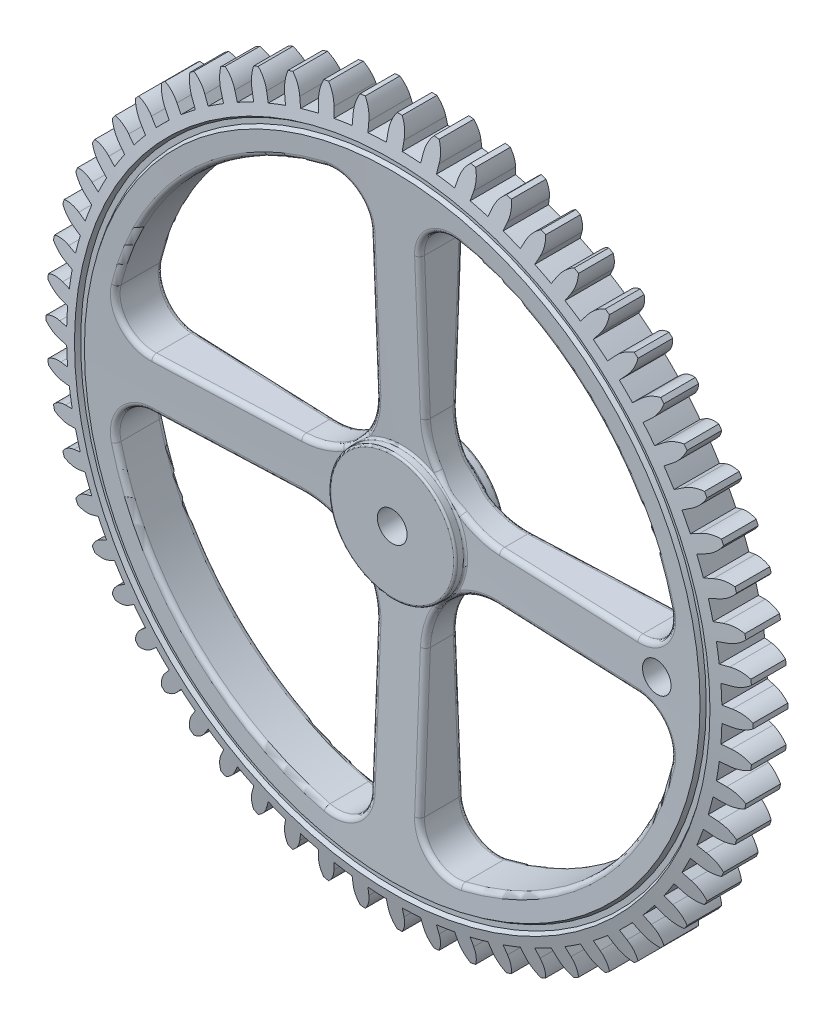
SolidWorks part; units mm, degrees
ref_plane "Front Plane" through (0, 0, 0) normal (0, 0, 1) x (1, 0, 0)
ref_plane "Top Plane" through (0, 0, 0) normal (0, 1, 0) x (1, 0, 0)
ref_plane "Right Plane" through (0, 0, 0) normal (1, 0, 0) x (0, 0, -1)
sketch "Sketch1" plane through (0, 0, 0) normal (1, 0, 0) x (0, 0, -1)
  line L0 (-5, 0) -> (5, 0)
  line L1 (-3.5, 71.3) -> (-5, 64.1)
  line L2 (3.5, 71.3) -> (-3.5, 71.3)
  line L3 (-5, 12.8) -> (-5, 0)
  line L4 (3.5, 71.3) -> (5, 64.1)
  line L5 (-5, 12.8) -> (-3, 12.8)
  line L6 (5, 62.1) -> (3, 12.8)
  line L7 (-4.2534, 63.6) -> (-4.2534, 62.6)
  line L8 (-5, 62.1) -> (-4.2534, 62.6)
  line L9 (-5, 64.1) -> (-4.2534, 63.6)
  line L10 (-5, 62.1) -> (-3, 12.8)
  line L11 (5, 12.8) -> (5, 0)
  line L12 (5, 62.1) -> (4.2534, 62.6)
  line L13 (4.2534, 63.6) -> (4.2534, 62.6)
  line L14 (5, 64.1) -> (4.2534, 63.6)
  line L15 (3, 12.8) -> (5, 12.8)
  line L16 (-5, 12.8) -> (5, 12.8) construction
  point P12 (-3, 12.8)
  dimension "D1" = 7
  dimension "D2" = 5
  dimension "D4" = 1.5
  dimension "D3" = 71.3
  dimension "D6" = 2
  dimension "D7" = 1
  dimension "D8" = 0.5
  dimension "D10" = 2
  dimension "D5" = 12.8
revolve "Revolve1" add sketch "Sketch1" angle 360 about L0
sketch "Sketch2" plane through (0, 0, 0) normal (0, 0, 1) x (1, 0, 0)
  line L0 (0.51, 71.2982) -> (-0.51, 71.2982)
  line L1 (5.499, 67.6268) -> (5.3161, 65.8859)
  line L2 (-1.6, 67.8311) -> (-1.6, 66.0806)
  line L3 (1.6, 67.8311) -> (1.6, 66.0806)
  line L4 (7.9599, 70.8543) -> (6.9455, 70.9609)
  line L5 (8.6815, 67.2923) -> (8.4985, 65.5514)
  line L6 (12.5378, 66.6815) -> (12.1739, 64.9693)
  line L7 (15.3226, 69.6341) -> (14.3249, 69.8462)
  line L8 (15.6679, 66.0162) -> (15.304, 64.304)
  line L9 (19.4393, 65.0057) -> (18.8983, 63.3408)
  line L10 (22.5174, 67.651) -> (21.5473, 67.9662)
  line L11 (22.4827, 64.0168) -> (21.9417, 62.352)
  line L12 (26.1277, 62.6176) -> (25.4157, 61.0184)
  line L13 (29.4655, 64.9267) -> (28.5337, 65.3416)
  line L14 (29.0511, 61.316) -> (28.3391, 59.7169)
  line L15 (32.5299, 59.5435) -> (31.6547, 58.0275)
  line L16 (36.0908, 61.491) -> (35.2074, 62.001)
  line L17 (35.3012, 57.9435) -> (34.426, 56.4275)
  line L18 (38.5757, 55.817) -> (37.5468, 54.4008)
  line L19 (42.3206, 57.3817) -> (41.4954, 57.9812)
  line L20 (41.1646, 53.9361) -> (40.1356, 52.5199)
  line L21 (44.1989, 51.479) -> (43.0275, 50.1781)
  line L22 (48.0868, 52.6436) -> (47.3288, 53.3261)
  line L23 (46.5769, 49.3377) -> (45.4056, 48.0369)
  line L24 (49.3377, 46.5769) -> (48.0369, 45.4056)
  line L25 (53.3261, 47.3288) -> (52.6436, 48.0868)
  line L26 (51.479, 44.1989) -> (50.1781, 43.0275)
  line L27 (53.9361, 41.1646) -> (52.5199, 40.1356)
  line L28 (57.9812, 41.4954) -> (57.3817, 42.3206)
  line L29 (55.817, 38.5757) -> (54.4008, 37.5468)
  line L30 (57.9435, 35.3012) -> (56.4275, 34.426)
  line L31 (62.001, 35.2074) -> (61.491, 36.0908)
  line L32 (59.5435, 32.5299) -> (58.0275, 31.6547)
  line L33 (61.316, 29.0511) -> (59.7169, 28.3391)
  line L34 (65.3416, 28.5337) -> (64.9267, 29.4655)
  line L35 (62.6176, 26.1277) -> (61.0184, 25.4157)
  line L36 (64.0168, 22.4827) -> (62.352, 21.9417)
  line L37 (67.9662, 21.5473) -> (67.651, 22.5174)
  line L38 (65.0057, 19.4393) -> (63.3408, 18.8983)
  line L39 (66.0162, 15.6679) -> (64.304, 15.304)
  line L40 (69.8462, 14.3249) -> (69.6341, 15.3226)
  line L41 (66.6815, 12.5378) -> (64.9693, 12.1739)
  line L42 (67.2923, 8.6815) -> (65.5514, 8.4985)
  line L43 (70.9609, 6.9455) -> (70.8543, 7.9599)
  line L44 (67.6268, 5.499) -> (65.8859, 5.3161)
  line L45 (67.8311, 1.6) -> (66.0806, 1.6)
  line L46 (71.2982, -0.51) -> (71.2982, 0.51)
  line L47 (67.8311, -1.6) -> (66.0806, -1.6)
  line L48 (67.6268, -5.499) -> (65.8859, -5.3161)
  line L49 (70.8543, -7.9599) -> (70.9609, -6.9455)
  line L50 (67.2923, -8.6815) -> (65.5514, -8.4985)
  line L51 (66.6815, -12.5378) -> (64.9693, -12.1739)
  line L52 (69.6341, -15.3226) -> (69.8462, -14.3249)
  line L53 (66.0162, -15.6679) -> (64.304, -15.304)
  line L54 (65.0057, -19.4393) -> (63.3408, -18.8983)
  line L55 (67.651, -22.5174) -> (67.9662, -21.5473)
  line L56 (64.0168, -22.4827) -> (62.352, -21.9417)
  line L57 (62.6176, -26.1277) -> (61.0184, -25.4157)
  line L58 (64.9267, -29.4655) -> (65.3416, -28.5337)
  line L59 (61.316, -29.0511) -> (59.7169, -28.3391)
  line L60 (59.5435, -32.5299) -> (58.0275, -31.6547)
  line L61 (61.491, -36.0908) -> (62.001, -35.2074)
  line L62 (57.9435, -35.3012) -> (56.4275, -34.426)
  line L63 (55.817, -38.5757) -> (54.4008, -37.5468)
  line L64 (57.3817, -42.3206) -> (57.9812, -41.4954)
  line L65 (53.9361, -41.1646) -> (52.5199, -40.1356)
  line L66 (51.479, -44.1989) -> (50.1781, -43.0275)
  line L67 (52.6436, -48.0868) -> (53.3261, -47.3288)
  line L68 (49.3377, -46.5769) -> (48.0369, -45.4056)
  line L69 (46.5769, -49.3377) -> (45.4056, -48.0369)
  line L70 (47.3288, -53.3261) -> (48.0868, -52.6436)
  line L71 (44.1989, -51.479) -> (43.0275, -50.1781)
  line L72 (41.1646, -53.9361) -> (40.1356, -52.5199)
  line L73 (41.4954, -57.9812) -> (42.3206, -57.3817)
  line L74 (38.5757, -55.817) -> (37.5468, -54.4008)
  line L75 (35.3012, -57.9435) -> (34.426, -56.4275)
  line L76 (35.2074, -62.001) -> (36.0908, -61.491)
  line L77 (32.5299, -59.5435) -> (31.6547, -58.0275)
  line L78 (29.0511, -61.316) -> (28.3391, -59.7169)
  line L79 (28.5337, -65.3416) -> (29.4655, -64.9267)
  line L80 (26.1277, -62.6176) -> (25.4157, -61.0184)
  line L81 (22.4827, -64.0168) -> (21.9417, -62.352)
  line L82 (21.5473, -67.9662) -> (22.5174, -67.651)
  line L83 (19.4393, -65.0057) -> (18.8983, -63.3408)
  line L84 (15.6679, -66.0162) -> (15.304, -64.304)
  line L85 (14.3249, -69.8462) -> (15.3226, -69.6341)
  line L86 (12.5378, -66.6815) -> (12.1739, -64.9693)
  line L87 (8.6815, -67.2923) -> (8.4985, -65.5514)
  line L88 (6.9455, -70.9609) -> (7.9599, -70.8543)
  line L89 (5.499, -67.6268) -> (5.3161, -65.8859)
  line L90 (1.6, -67.8311) -> (1.6, -66.0806)
  line L91 (-0.51, -71.2982) -> (0.51, -71.2982)
  line L92 (-1.6, -67.8311) -> (-1.6, -66.0806)
  line L93 (-5.499, -67.6268) -> (-5.3161, -65.8859)
  line L94 (-7.9599, -70.8543) -> (-6.9455, -70.9609)
  line L95 (-8.6815, -67.2923) -> (-8.4985, -65.5514)
  line L96 (-12.5378, -66.6815) -> (-12.1739, -64.9693)
  line L97 (-15.3226, -69.6341) -> (-14.3249, -69.8462)
  line L98 (-15.6679, -66.0162) -> (-15.304, -64.304)
  line L99 (-19.4393, -65.0057) -> (-18.8983, -63.3408)
  line L100 (-22.5174, -67.651) -> (-21.5473, -67.9662)
  line L101 (-22.4827, -64.0168) -> (-21.9417, -62.352)
  line L102 (-26.1277, -62.6176) -> (-25.4157, -61.0184)
  line L103 (-29.4655, -64.9267) -> (-28.5337, -65.3416)
  line L104 (-29.0511, -61.316) -> (-28.3391, -59.7169)
  line L105 (-32.5299, -59.5435) -> (-31.6547, -58.0275)
  line L106 (-36.0908, -61.491) -> (-35.2074, -62.001)
  line L107 (-35.3012, -57.9435) -> (-34.426, -56.4275)
  line L108 (-38.5757, -55.817) -> (-37.5468, -54.4008)
  line L109 (-42.3206, -57.3817) -> (-41.4954, -57.9812)
  line L110 (-41.1646, -53.9361) -> (-40.1356, -52.5199)
  line L111 (-44.1989, -51.479) -> (-43.0275, -50.1781)
  line L112 (-48.0868, -52.6436) -> (-47.3288, -53.3261)
  line L113 (-46.5769, -49.3377) -> (-45.4056, -48.0369)
  line L114 (-49.3377, -46.5769) -> (-48.0369, -45.4056)
  line L115 (-53.3261, -47.3288) -> (-52.6436, -48.0868)
  line L116 (-51.479, -44.1989) -> (-50.1781, -43.0275)
  line L117 (-53.9361, -41.1646) -> (-52.5199, -40.1356)
  line L118 (-57.9812, -41.4954) -> (-57.3817, -42.3206)
  line L119 (-55.817, -38.5757) -> (-54.4008, -37.5468)
  line L120 (-57.9435, -35.3012) -> (-56.4275, -34.426)
  line L121 (-62.001, -35.2074) -> (-61.491, -36.0908)
  line L122 (-59.5435, -32.5299) -> (-58.0275, -31.6547)
  line L123 (-61.316, -29.0511) -> (-59.7169, -28.3391)
  line L124 (-65.3416, -28.5337) -> (-64.9267, -29.4655)
  line L125 (-62.6176, -26.1277) -> (-61.0184, -25.4157)
  line L126 (-64.0168, -22.4827) -> (-62.352, -21.9417)
  line L127 (-67.9662, -21.5473) -> (-67.651, -22.5174)
  line L128 (-65.0057, -19.4393) -> (-63.3408, -18.8983)
  line L129 (-66.0162, -15.6679) -> (-64.304, -15.304)
  line L130 (-69.8462, -14.3249) -> (-69.6341, -15.3226)
  line L131 (-66.6815, -12.5378) -> (-64.9693, -12.1739)
  line L132 (-67.2923, -8.6815) -> (-65.5514, -8.4985)
  line L133 (-70.9609, -6.9455) -> (-70.8543, -7.9599)
  line L134 (-67.6268, -5.499) -> (-65.8859, -5.3161)
  line L135 (-67.8311, -1.6) -> (-66.0806, -1.6)
  line L136 (-71.2982, 0.51) -> (-71.2982, -0.51)
  line L137 (-67.8311, 1.6) -> (-66.0806, 1.6)
  line L138 (-67.6268, 5.499) -> (-65.8859, 5.3161)
  line L139 (-70.8543, 7.9599) -> (-70.9609, 6.9455)
  line L140 (-67.2923, 8.6815) -> (-65.5514, 8.4985)
  line L141 (-66.6815, 12.5378) -> (-64.9693, 12.1739)
  line L142 (-69.6341, 15.3226) -> (-69.8462, 14.3249)
  line L143 (-66.0162, 15.6679) -> (-64.304, 15.304)
  line L144 (-65.0057, 19.4393) -> (-63.3408, 18.8983)
  line L145 (-67.651, 22.5174) -> (-67.9662, 21.5473)
  line L146 (-64.0168, 22.4827) -> (-62.352, 21.9417)
  line L147 (-62.6176, 26.1277) -> (-61.0184, 25.4157)
  line L148 (-64.9267, 29.4655) -> (-65.3416, 28.5337)
  line L149 (-61.316, 29.0511) -> (-59.7169, 28.3391)
  line L150 (-59.5435, 32.5299) -> (-58.0275, 31.6547)
  line L151 (-61.491, 36.0908) -> (-62.001, 35.2074)
  line L152 (-57.9435, 35.3012) -> (-56.4275, 34.426)
  line L153 (-55.817, 38.5757) -> (-54.4008, 37.5468)
  line L154 (-57.3817, 42.3206) -> (-57.9812, 41.4954)
  line L155 (-53.9361, 41.1646) -> (-52.5199, 40.1356)
  line L156 (-51.479, 44.1989) -> (-50.1781, 43.0275)
  line L157 (-52.6436, 48.0868) -> (-53.3261, 47.3288)
  line L158 (-49.3377, 46.5769) -> (-48.0369, 45.4056)
  line L159 (-46.5769, 49.3377) -> (-45.4056, 48.0369)
  line L160 (-47.3288, 53.3261) -> (-48.0868, 52.6436)
  line L161 (-44.1989, 51.479) -> (-43.0275, 50.1781)
  line L162 (-41.1646, 53.9361) -> (-40.1356, 52.5199)
  line L163 (-41.4954, 57.9812) -> (-42.3206, 57.3817)
  line L164 (-38.5757, 55.817) -> (-37.5468, 54.4008)
  line L165 (-35.3012, 57.9435) -> (-34.426, 56.4275)
  line L166 (-35.2074, 62.001) -> (-36.0908, 61.491)
  line L167 (-32.5299, 59.5435) -> (-31.6547, 58.0275)
  line L168 (-29.0511, 61.316) -> (-28.3391, 59.7169)
  line L169 (-28.5337, 65.3416) -> (-29.4655, 64.9267)
  line L170 (-26.1277, 62.6176) -> (-25.4157, 61.0184)
  line L171 (-22.4827, 64.0168) -> (-21.9417, 62.352)
  line L172 (-21.5473, 67.9662) -> (-22.5174, 67.651)
  line L173 (-19.4393, 65.0057) -> (-18.8983, 63.3408)
  line L174 (-15.6679, 66.0162) -> (-15.304, 64.304)
  line L175 (-14.3249, 69.8462) -> (-15.3226, 69.6341)
  line L176 (-12.5378, 66.6815) -> (-12.1739, 64.9693)
  line L177 (-8.6815, 67.2923) -> (-8.4985, 65.5514)
  line L178 (-6.9455, 70.9609) -> (-7.9599, 70.8543)
  line L179 (-5.499, 67.6268) -> (-5.3161, 65.8859)
  arc A0 (6.9455, 70.9609) -> (5.499, 67.6268) centre (11.4681, 67.0181) ccw
  arc A1 (-1.6, 66.0806) -> (1.6, 66.0806) centre (0, 0) ccw
  circle A2 centre (0, 0) radius 71.3 construction
  arc A3 (-0.51, 71.2982) -> (-1.6, 67.8311) centre (4.4, 67.8497) ccw
  arc A4 (0.51, 71.2982) -> (1.6, 67.8311) centre (-4.4, 67.8497) cw
  arc A5 (7.9599, 70.8543) -> (8.6815, 67.2923) centre (2.7164, 67.9379) cw
  arc A6 (14.3249, 69.8462) -> (12.5378, 66.6815) centre (18.4106, 65.4522) ccw
  arc A7 (15.3226, 69.6341) -> (15.6679, 66.0162) centre (9.8029, 67.2818) cw
  arc A8 (21.5473, 67.9662) -> (19.4393, 65.0057) centre (25.1513, 63.1692) ccw
  arc A9 (22.5174, 67.651) -> (22.4827, 64.0168) centre (16.7821, 65.8885) cw
  arc A10 (28.5337, 65.3416) -> (26.1277, 62.6176) centre (31.6165, 60.1941) ccw
  arc A11 (29.4655, 64.9267) -> (29.0511, 61.316) centre (23.5774, 63.7734) cw
  arc A12 (35.2074, 62.001) -> (32.5299, 59.5435) centre (37.7353, 56.5596) ccw
  arc A13 (36.0908, 61.491) -> (35.3012, 57.9435) centre (30.1143, 60.9595) cw
  arc A14 (41.4954, 57.9812) -> (38.5757, 55.817) centre (43.4407, 52.3053) ccw
  arc A15 (42.3206, 57.3817) -> (41.1646, 53.9361) centre (36.3214, 57.4778) cw
  arc A16 (47.3288, 53.3261) -> (44.1989, 51.479) centre (48.6701, 47.478) ccw
  arc A17 (48.0868, 52.6436) -> (46.5769, 49.3377) centre (42.1305, 53.3663) cw
  arc A18 (52.6436, 48.0868) -> (49.3377, 46.5769) centre (53.3663, 42.1305) ccw
  arc A19 (53.3261, 47.3288) -> (51.479, 44.1989) centre (47.478, 48.6701) cw
  arc A20 (57.3817, 42.3206) -> (53.9361, 41.1646) centre (57.4778, 36.3214) ccw
  arc A21 (57.9812, 41.4954) -> (55.817, 38.5757) centre (52.3053, 43.4407) cw
  arc A22 (61.491, 36.0908) -> (57.9435, 35.3012) centre (60.9595, 30.1143) ccw
  arc A23 (62.001, 35.2074) -> (59.5435, 32.5299) centre (56.5596, 37.7353) cw
  arc A24 (64.9267, 29.4655) -> (61.316, 29.0511) centre (63.7734, 23.5774) ccw
  arc A25 (65.3416, 28.5337) -> (62.6176, 26.1277) centre (60.1941, 31.6165) cw
  arc A26 (67.651, 22.5174) -> (64.0168, 22.4827) centre (65.8885, 16.7821) ccw
  arc A27 (67.9662, 21.5473) -> (65.0057, 19.4393) centre (63.1692, 25.1513) cw
  arc A28 (69.6341, 15.3226) -> (66.0162, 15.6679) centre (67.2818, 9.8029) ccw
  arc A29 (69.8462, 14.3249) -> (66.6815, 12.5378) centre (65.4522, 18.4106) cw
  arc A30 (70.8543, 7.9599) -> (67.2923, 8.6815) centre (67.9379, 2.7164) ccw
  arc A31 (70.9609, 6.9455) -> (67.6268, 5.499) centre (67.0181, 11.4681) cw
  arc A32 (71.2982, 0.51) -> (67.8311, 1.6) centre (67.8497, -4.4) ccw
  arc A33 (71.2982, -0.51) -> (67.8311, -1.6) centre (67.8497, 4.4) cw
  arc A34 (70.9609, -6.9455) -> (67.6268, -5.499) centre (67.0181, -11.4681) ccw
  arc A35 (70.8543, -7.9599) -> (67.2923, -8.6815) centre (67.9379, -2.7164) cw
  arc A36 (69.8462, -14.3249) -> (66.6815, -12.5378) centre (65.4522, -18.4106) ccw
  arc A37 (69.6341, -15.3226) -> (66.0162, -15.6679) centre (67.2818, -9.8029) cw
  arc A38 (67.9662, -21.5473) -> (65.0057, -19.4393) centre (63.1692, -25.1513) ccw
  arc A39 (67.651, -22.5174) -> (64.0168, -22.4827) centre (65.8885, -16.7821) cw
  arc A40 (65.3416, -28.5337) -> (62.6176, -26.1277) centre (60.1941, -31.6165) ccw
  arc A41 (64.9267, -29.4655) -> (61.316, -29.0511) centre (63.7734, -23.5774) cw
  arc A42 (62.001, -35.2074) -> (59.5435, -32.5299) centre (56.5596, -37.7353) ccw
  arc A43 (61.491, -36.0908) -> (57.9435, -35.3012) centre (60.9595, -30.1143) cw
  arc A44 (57.9812, -41.4954) -> (55.817, -38.5757) centre (52.3053, -43.4407) ccw
  arc A45 (57.3817, -42.3206) -> (53.9361, -41.1646) centre (57.4778, -36.3214) cw
  arc A46 (53.3261, -47.3288) -> (51.479, -44.1989) centre (47.478, -48.6701) ccw
  arc A47 (52.6436, -48.0868) -> (49.3377, -46.5769) centre (53.3663, -42.1305) cw
  arc A48 (48.0868, -52.6436) -> (46.5769, -49.3377) centre (42.1305, -53.3663) ccw
  arc A49 (47.3288, -53.3261) -> (44.1989, -51.479) centre (48.6701, -47.478) cw
  arc A50 (42.3206, -57.3817) -> (41.1646, -53.9361) centre (36.3214, -57.4778) ccw
  arc A51 (41.4954, -57.9812) -> (38.5757, -55.817) centre (43.4407, -52.3053) cw
  arc A52 (36.0908, -61.491) -> (35.3012, -57.9435) centre (30.1143, -60.9595) ccw
  arc A53 (35.2074, -62.001) -> (32.5299, -59.5435) centre (37.7353, -56.5596) cw
  arc A54 (29.4655, -64.9267) -> (29.0511, -61.316) centre (23.5774, -63.7734) ccw
  arc A55 (28.5337, -65.3416) -> (26.1277, -62.6176) centre (31.6165, -60.1941) cw
  arc A56 (22.5174, -67.651) -> (22.4827, -64.0168) centre (16.7821, -65.8885) ccw
  arc A57 (21.5473, -67.9662) -> (19.4393, -65.0057) centre (25.1513, -63.1692) cw
  arc A58 (15.3226, -69.6341) -> (15.6679, -66.0162) centre (9.8029, -67.2818) ccw
  arc A59 (14.3249, -69.8462) -> (12.5378, -66.6815) centre (18.4106, -65.4522) cw
  arc A60 (7.9599, -70.8543) -> (8.6815, -67.2923) centre (2.7164, -67.9379) ccw
  arc A61 (6.9455, -70.9609) -> (5.499, -67.6268) centre (11.4681, -67.0181) cw
  arc A62 (0.51, -71.2982) -> (1.6, -67.8311) centre (-4.4, -67.8497) ccw
  arc A63 (-0.51, -71.2982) -> (-1.6, -67.8311) centre (4.4, -67.8497) cw
  arc A64 (-6.9455, -70.9609) -> (-5.499, -67.6268) centre (-11.4681, -67.0181) ccw
  arc A65 (-7.9599, -70.8543) -> (-8.6815, -67.2923) centre (-2.7164, -67.9379) cw
  arc A66 (-14.3249, -69.8462) -> (-12.5378, -66.6815) centre (-18.4106, -65.4522) ccw
  arc A67 (-15.3226, -69.6341) -> (-15.6679, -66.0162) centre (-9.8029, -67.2818) cw
  arc A68 (-21.5473, -67.9662) -> (-19.4393, -65.0057) centre (-25.1513, -63.1692) ccw
  arc A69 (-22.5174, -67.651) -> (-22.4827, -64.0168) centre (-16.7821, -65.8885) cw
  arc A70 (-28.5337, -65.3416) -> (-26.1277, -62.6176) centre (-31.6165, -60.1941) ccw
  arc A71 (-29.4655, -64.9267) -> (-29.0511, -61.316) centre (-23.5774, -63.7734) cw
  arc A72 (-35.2074, -62.001) -> (-32.5299, -59.5435) centre (-37.7353, -56.5596) ccw
  arc A73 (-36.0908, -61.491) -> (-35.3012, -57.9435) centre (-30.1143, -60.9595) cw
  arc A74 (-41.4954, -57.9812) -> (-38.5757, -55.817) centre (-43.4407, -52.3053) ccw
  arc A75 (-42.3206, -57.3817) -> (-41.1646, -53.9361) centre (-36.3214, -57.4778) cw
  arc A76 (-47.3288, -53.3261) -> (-44.1989, -51.479) centre (-48.6701, -47.478) ccw
  arc A77 (-48.0868, -52.6436) -> (-46.5769, -49.3377) centre (-42.1305, -53.3663) cw
  arc A78 (-52.6436, -48.0868) -> (-49.3377, -46.5769) centre (-53.3663, -42.1305) ccw
  arc A79 (-53.3261, -47.3288) -> (-51.479, -44.1989) centre (-47.478, -48.6701) cw
  arc A80 (-57.3817, -42.3206) -> (-53.9361, -41.1646) centre (-57.4778, -36.3214) ccw
  arc A81 (-57.9812, -41.4954) -> (-55.817, -38.5757) centre (-52.3053, -43.4407) cw
  arc A82 (-61.491, -36.0908) -> (-57.9435, -35.3012) centre (-60.9595, -30.1143) ccw
  arc A83 (-62.001, -35.2074) -> (-59.5435, -32.5299) centre (-56.5596, -37.7353) cw
  arc A84 (-64.9267, -29.4655) -> (-61.316, -29.0511) centre (-63.7734, -23.5774) ccw
  arc A85 (-65.3416, -28.5337) -> (-62.6176, -26.1277) centre (-60.1941, -31.6165) cw
  arc A86 (-67.651, -22.5174) -> (-64.0168, -22.4827) centre (-65.8885, -16.7821) ccw
  arc A87 (-67.9662, -21.5473) -> (-65.0057, -19.4393) centre (-63.1692, -25.1513) cw
  arc A88 (-69.6341, -15.3226) -> (-66.0162, -15.6679) centre (-67.2818, -9.8029) ccw
  arc A89 (-69.8462, -14.3249) -> (-66.6815, -12.5378) centre (-65.4522, -18.4106) cw
  arc A90 (-70.8543, -7.9599) -> (-67.2923, -8.6815) centre (-67.9379, -2.7164) ccw
  arc A91 (-70.9609, -6.9455) -> (-67.6268, -5.499) centre (-67.0181, -11.4681) cw
  arc A92 (-71.2982, -0.51) -> (-67.8311, -1.6) centre (-67.8497, 4.4) ccw
  arc A93 (-71.2982, 0.51) -> (-67.8311, 1.6) centre (-67.8497, -4.4) cw
  arc A94 (-70.9609, 6.9455) -> (-67.6268, 5.499) centre (-67.0181, 11.4681) ccw
  arc A95 (-70.8543, 7.9599) -> (-67.2923, 8.6815) centre (-67.9379, 2.7164) cw
  arc A96 (-69.8462, 14.3249) -> (-66.6815, 12.5378) centre (-65.4522, 18.4106) ccw
  arc A97 (-69.6341, 15.3226) -> (-66.0162, 15.6679) centre (-67.2818, 9.8029) cw
  arc A98 (-67.9662, 21.5473) -> (-65.0057, 19.4393) centre (-63.1692, 25.1513) ccw
  arc A99 (-67.651, 22.5174) -> (-64.0168, 22.4827) centre (-65.8885, 16.7821) cw
  arc A100 (-65.3416, 28.5337) -> (-62.6176, 26.1277) centre (-60.1941, 31.6165) ccw
  arc A101 (-64.9267, 29.4655) -> (-61.316, 29.0511) centre (-63.7734, 23.5774) cw
  arc A102 (-62.001, 35.2074) -> (-59.5435, 32.5299) centre (-56.5596, 37.7353) ccw
  arc A103 (-61.491, 36.0908) -> (-57.9435, 35.3012) centre (-60.9595, 30.1143) cw
  arc A104 (-57.9812, 41.4954) -> (-55.817, 38.5757) centre (-52.3053, 43.4407) ccw
  arc A105 (-57.3817, 42.3206) -> (-53.9361, 41.1646) centre (-57.4778, 36.3214) cw
  arc A106 (-53.3261, 47.3288) -> (-51.479, 44.1989) centre (-47.478, 48.6701) ccw
  arc A107 (-52.6436, 48.0868) -> (-49.3377, 46.5769) centre (-53.3663, 42.1305) cw
  arc A108 (-48.0868, 52.6436) -> (-46.5769, 49.3377) centre (-42.1305, 53.3663) ccw
  arc A109 (-47.3288, 53.3261) -> (-44.1989, 51.479) centre (-48.6701, 47.478) cw
  arc A110 (-42.3206, 57.3817) -> (-41.1646, 53.9361) centre (-36.3214, 57.4778) ccw
  arc A111 (-41.4954, 57.9812) -> (-38.5757, 55.817) centre (-43.4407, 52.3053) cw
  arc A112 (-36.0908, 61.491) -> (-35.3012, 57.9435) centre (-30.1143, 60.9595) ccw
  arc A113 (-35.2074, 62.001) -> (-32.5299, 59.5435) centre (-37.7353, 56.5596) cw
  arc A114 (-29.4655, 64.9267) -> (-29.0511, 61.316) centre (-23.5774, 63.7734) ccw
  arc A115 (-28.5337, 65.3416) -> (-26.1277, 62.6176) centre (-31.6165, 60.1941) cw
  arc A116 (-22.5174, 67.651) -> (-22.4827, 64.0168) centre (-16.7821, 65.8885) ccw
  arc A117 (-21.5473, 67.9662) -> (-19.4393, 65.0057) centre (-25.1513, 63.1692) cw
  arc A118 (-15.3226, 69.6341) -> (-15.6679, 66.0162) centre (-9.8029, 67.2818) ccw
  arc A119 (-14.3249, 69.8462) -> (-12.5378, 66.6815) centre (-18.4106, 65.4522) cw
  arc A120 (-7.9599, 70.8543) -> (-8.6815, 67.2923) centre (-2.7164, 67.9379) ccw
  arc A121 (-6.9455, 70.9609) -> (-5.499, 67.6268) centre (-11.4681, 67.0181) cw
  circle A122 centre (0, 0) radius 71.3
  point P9 (0, 71.2982)
  point P487 (0, 0)
  dimension "D1" = 60
  dimension "D2" = 132.2
  dimension "D7" = 6
  dimension "D8" = 6
  dimension "D3" = 1.02
  dimension "D4" = 0.51
extrude "Cut-Extrude2" cut sketch "Sketch2" against normal through all both and the other way through all contours A114 A122 A113 L167 A1 L168 | A116 A122 A115 L170 A1 L171 | A118 A122 A117 L173 A1 L174 | A120 A122 A119 L176 A1 L177 | A3 A122 A121 L179 A1 L2 | A0 A122 A4 L3 A1 L1 | A6 A122 A5 L5 A1 L6 | A8 A122 A7 L8 A1 L9 | A10 A122 A9 L11 A1 L12 | A12 A122 A11 L14 A1 L15 | A14 A122 A13 L17 A1 L18 | A16 A122 A15 L20 A1 L21 | A18 A122 A17 L23 A1 L24 | A20 A122 A19 L26 A1 L27 | A22 A122 A21 L29 A1 L30 | A24 A122 A23 L32 A1 L33 | A26 A122 A25 L35 A1 L36 | A28 A122 A27 L38 A1 L39 | A30 A122 A29 L41 A1 L42 | A32 A122 A31 L44 A1 L45 | A34 A122 A33 L47 A1 L48 | A36 A122 A35 L50 A1 L51 | A38 A122 A37 L53 A1 L54 | A40 A122 A39 L56 A1 L57 | A42 A122 A41 L59 A1 L60 | A44 A122 A43 L62 A1 L63 | A46 A122 A45 L65 A1 L66 | A48 A122 A47 L68 A1 L69 | A50 A122 A49 L71 A1 L72 | A52 A122 A51 L74 A1 L75 | A54 A122 A53 L77 A1 L78 | A56 A122 A55 L80 A1 L81 | A58 A122 A57 L83 A1 L84 | A60 A122 A59 L86 A1 L87 | A62 A122 A61 L89 A1 L90 | A64 A122 A63 L92 A1 L93 | A66 A122 A65 L95 A1 L96 | A68 A122 A67 L98 A1 L99 | A70 A122 A69 L101 A1 L102 | A72 A122 A71 L104 A1 L105 | A74 A122 A73 L107 A1 L108 | A76 A122 A75 L110 A1 L111 | A78 A122 A77 L113 A1 L114 | A80 A122 A79 L116 A1 L117 | A82 A122 A81 L119 A1 L120 | A84 A122 A83 L122 A1 L123 | A86 A122 A85 L125 A1 L126 | A88 A122 A87 L128 A1 L129 | A90 A122 A89 L131 A1 L132 | A92 A122 A91 L134 A1 L135 | A94 A122 A93 L137 A1 L138 | A96 A122 A95 L140 A1 L141 | A98 A122 A97 L143 A1 L144 | A100 A122 A99 L146 A1 L147 | A102 A122 A101 L149 A1 L150 | A104 A122 A103 L152 A1 L153 | A106 A122 A105 L155 A1 L156 | A108 A122 A107 L158 A1 L159 | A110 A122 A109 L161 A1 L162 | A112 A122 A111 L164 A1 L165
sketch "Sketch3" plane through (0, 0, 0) normal (0, 0, 1) x (1, 0, 0)
  line L0 (20, -5) -> (49.0535, -5)
  line L1 (5, -20) -> (5, -49.0535)
  line L2 (5, 20) -> (5, 49.0535)
  line L3 (20, 5) -> (49.0535, 5)
  line L4 (-5, -20) -> (-5, -49.0535)
  line L5 (-20, -5) -> (-49.0535, -5)
  line L6 (-20, 5) -> (-49.0535, 5)
  line L7 (-5, 20) -> (-5, 49.0535)
  arc A0 (49.0535, -5) -> (55.853, -13.6634) centre (49.0535, -12) cw
  arc A1 (55.853, 13.6634) -> (13.6634, 55.853) centre (0, 0) ccw
  arc A2 (49.0535, 5) -> (55.853, 13.6634) centre (49.0535, 12) ccw
  arc A3 (5, 49.0535) -> (13.6634, 55.853) centre (12, 49.0535) cw
  arc A4 (5, 20) -> (20, 5) centre (20, 20) ccw
  arc A5 (13.6634, -55.853) -> (55.853, -13.6634) centre (0, 0) ccw
  arc A6 (5, -49.0535) -> (13.6634, -55.853) centre (12, -49.0535) ccw
  arc A7 (20, -5) -> (5, -20) centre (20, -20) ccw
  arc A8 (-5, -49.0535) -> (-13.6634, -55.853) centre (-12, -49.0535) cw
  arc A9 (-55.853, -13.6634) -> (-13.6634, -55.853) centre (0, 0) ccw
  arc A10 (-49.0535, -5) -> (-55.853, -13.6634) centre (-49.0535, -12) ccw
  arc A11 (-5, -20) -> (-20, -5) centre (-20, -20) ccw
  arc A12 (-49.0535, 5) -> (-55.853, 13.6634) centre (-49.0535, 12) cw
  arc A13 (-13.6634, 55.853) -> (-55.853, 13.6634) centre (0, 0) ccw
  arc A14 (-5, 49.0535) -> (-13.6634, 55.853) centre (-12, 49.0535) ccw
  arc A15 (-20, 5) -> (-5, 20) centre (-20, 20) ccw
  point P11 (57.2822, 5)
  point P42 (0, 0)
  dimension "D1" = 4
  dimension "D3" = 7
  dimension "D4" = 15
extrude "Cut-Extrude3" cut sketch "Sketch3" against normal through all both and the other way through all
fillet "Fillet6" radius 0.4 4 edges at (12.8, 0, -3) (12.8, 0, -5) (12.8, 0, 5) (12.8, 0, 3)
fillet "Fillet7" radius 1 48 edges at (10.472, 8.4148, 3.0257) (54.0713, 7.1192, 4.6932) (40.6586, 40.6586, 4.8134) (8.2941, 54.9921, 4.7369) (-7.1192, 54.0713, 4.6932) (-40.6586, 40.6586, 4.8134) (-54.9921, 8.2941, 4.7369) (-8.4148, 10.472, 3.0257) (7.1192, -54.0713, 4.6932) (40.6586, -40.6586, 4.8134) (54.9921, -8.2941, 4.7369) (8.4148, -10.472, 3.0257) (-10.472, -8.4148, 3.0257) (-54.0713, -7.1192, 4.6932) (-40.6586, -40.6586, 4.8134) (-8.2941, -54.9921, 4.7369) (54.9921, -8.2941, -4.7369) (8.4148, -10.472, -3.0257) (7.1192, -54.0713, -4.6932) (-10.472, -8.4148, -3.0257) (-54.0713, -7.1192, -4.6932) (-40.6586, -40.6586, -4.8134) (-8.2941, -54.9921, -4.7369) (10.472, 8.4148, -3.0257) (54.0713, 7.1192, -4.6932) (40.6586, 40.6586, -4.8134) (8.2941, 54.9921, -4.7369) (-7.1192, 54.0713, -4.6932) (-40.6586, 40.6586, -4.8134) (-54.9921, 8.2941, -4.7369) (-8.4148, 10.472, -3.0257) (40.6586, -40.6586, -4.8134)
sketch "Sketch4" plane through (0, 0, -5) normal (0, 0, -1) x (-1, 0, 0)
  circle A0 centre (0, 0) radius 3
  dimension "D1" = 6
extrude "Cut-Extrude5" cut sketch "Sketch4" against normal blind 40
sketch "Sketch5" plane through (0, 0, 0) normal (0, 0, 1) x (1, 0, 0)
  circle A0 centre (53, 0) radius 3
  dimension "D1" = 6
  dimension "D2" = 53
extrude "Cut-Extrude6" cut sketch "Sketch5" against normal mid plane 10
